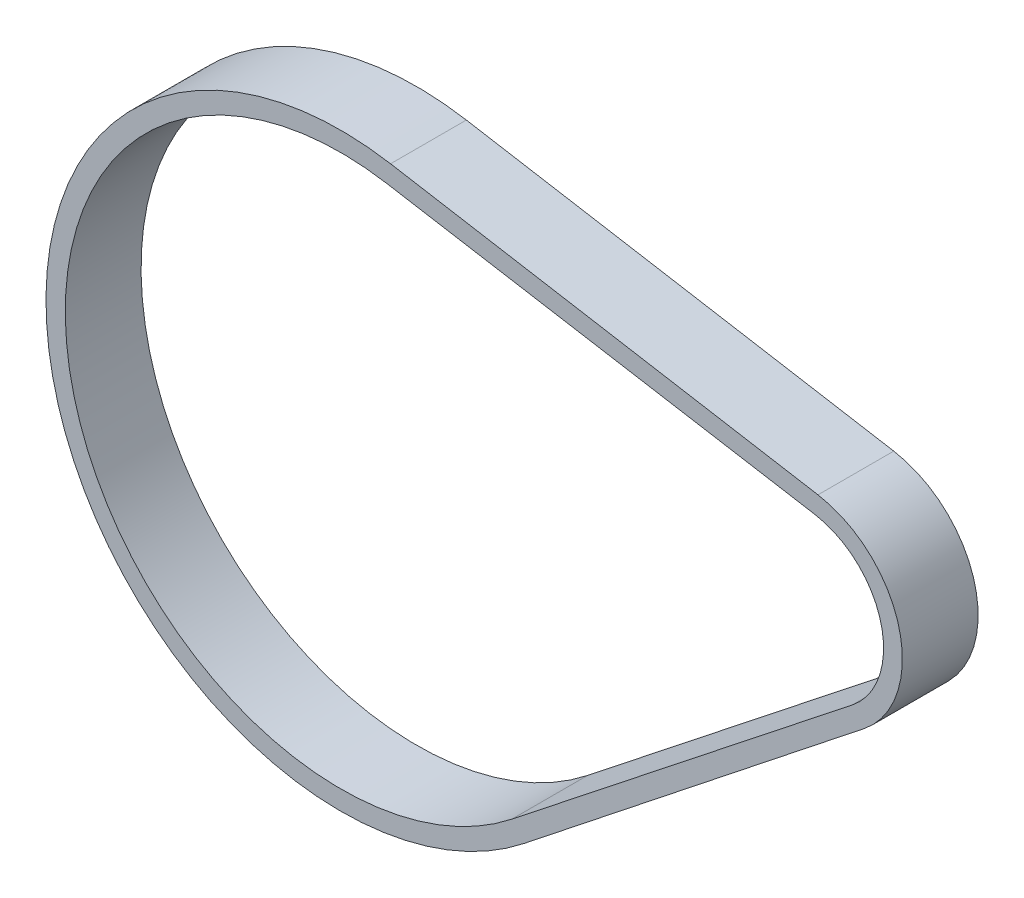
SolidWorks part; units mm, degrees
ref_plane "Plan1" through (0, 0, 0) normal (0, 0, 1) x (1, 0, 0)
ref_plane "Plan2" through (0, 0, 0) normal (0, 1, 0) x (1, 0, 0)
ref_plane "Plan3" through (0, 0, 0) normal (1, 0, 0) x (0, 0, -1)
sketch "Esquisse1" plane through (0, 0, 0) normal (0, 0, 1) x (1, 0, 0)
  line L0 (18.3511, 107.4441) -> (176.3134, 80.4647)
  line L1 (67.7027, -85.4245) -> (193.2922, 14.1108)
  line L2 (17.0237, 100.4274) -> (175.1074, 73.6302)
  line L3 (63.1682, -79.9077) -> (188.9517, 19.5261)
  arc A0 (17.0237, 100.4274) -> (63.1682, -79.9077) centre (0, 0) ccw
  arc A1 (18.3511, 107.4441) -> (67.7027, -85.4245) centre (0, 0) ccw
  arc A2 (188.9517, 19.5261) -> (175.1074, 73.6302) centre (170, 43.5) ccw
  arc A3 (193.2922, 14.1108) -> (176.3134, 80.4647) centre (170, 43.5) ccw
  dimension "D1" = 203.72
  dimension "D2" = 218
  dimension "D3" = 61.12
  dimension "D4" = 75
  dimension "D5" = 170
  dimension "D6" = 43.5
  dimension "D7" = 175.4772
extrude "Base-Extrusion" add sketch "Esquisse1" along normal blind 28
